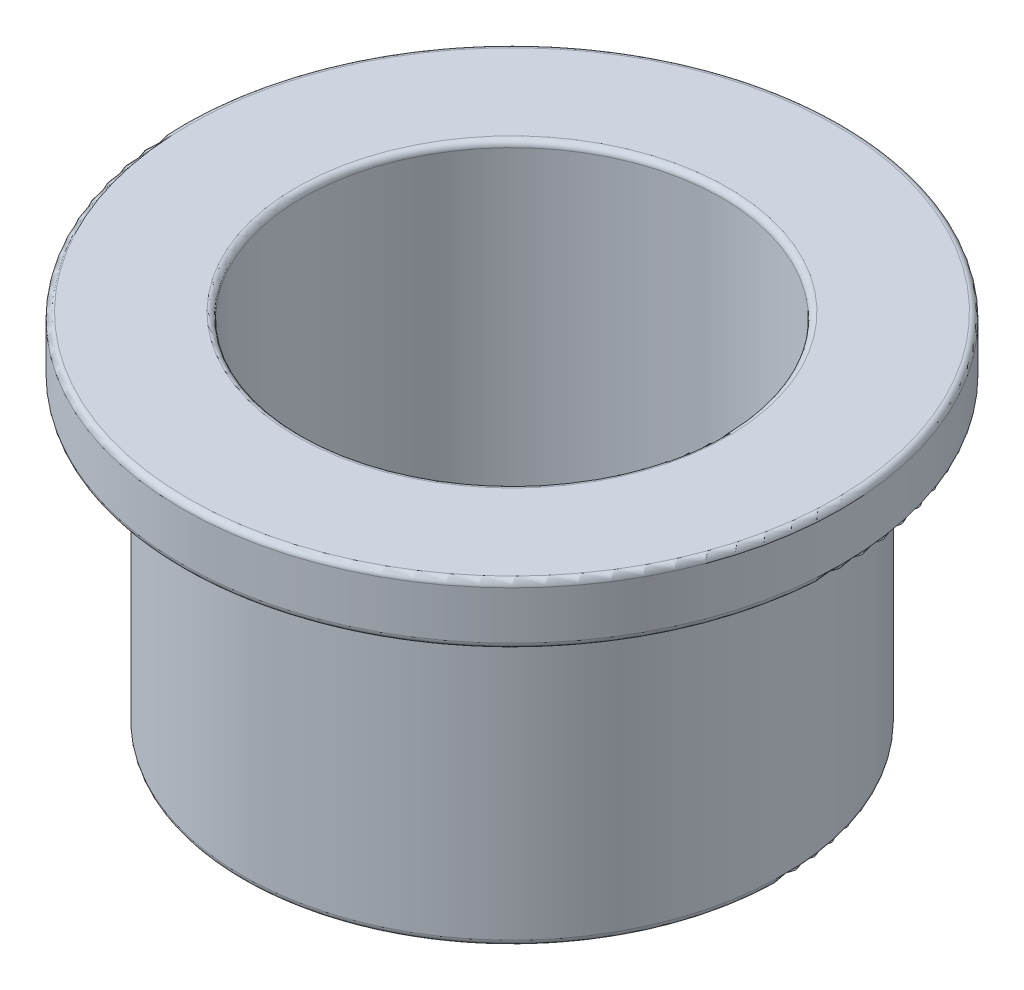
SolidWorks part; units mm, degrees
ref_plane "Face" through (0, 0, 0) normal (0, 0, 1) x (1, 0, 0)
ref_plane "Dessus" through (0, 0, 0) normal (0, 1, 0) x (1, 0, 0)
ref_plane "Droite" through (0, 0, 0) normal (1, 0, 0) x (0, 0, -1)
sketch "Esquisse1" plane through (0, 0, 0) normal (0, 0, 1) x (1, 0, 0)
  line L0 (0, 0) -> (0, 66.9889) construction
  line L1 (7, 0) -> (7, 12)
  line L2 (7, 12) -> (11, 12)
  line L3 (11, 12) -> (11, 10)
  line L4 (11, 10) -> (9, 10)
  line L5 (9, 10) -> (9, 0)
  line L6 (9, 0) -> (7, 0)
  dimension "D1" = 2
  dimension "D2" = 12
  dimension "D3" = 14
  dimension "D4" = 18
  dimension "D5" = 22
revolve "Révolution1" add sketch "Esquisse1" angle 360 about L0
fillet "Congé1" radius 0.2 6 edges at (0, 0, -7) (0, 0, -9) (0, 10, -9) (0, 12, -7) (0, 10, -11) (0, 12, -11)
